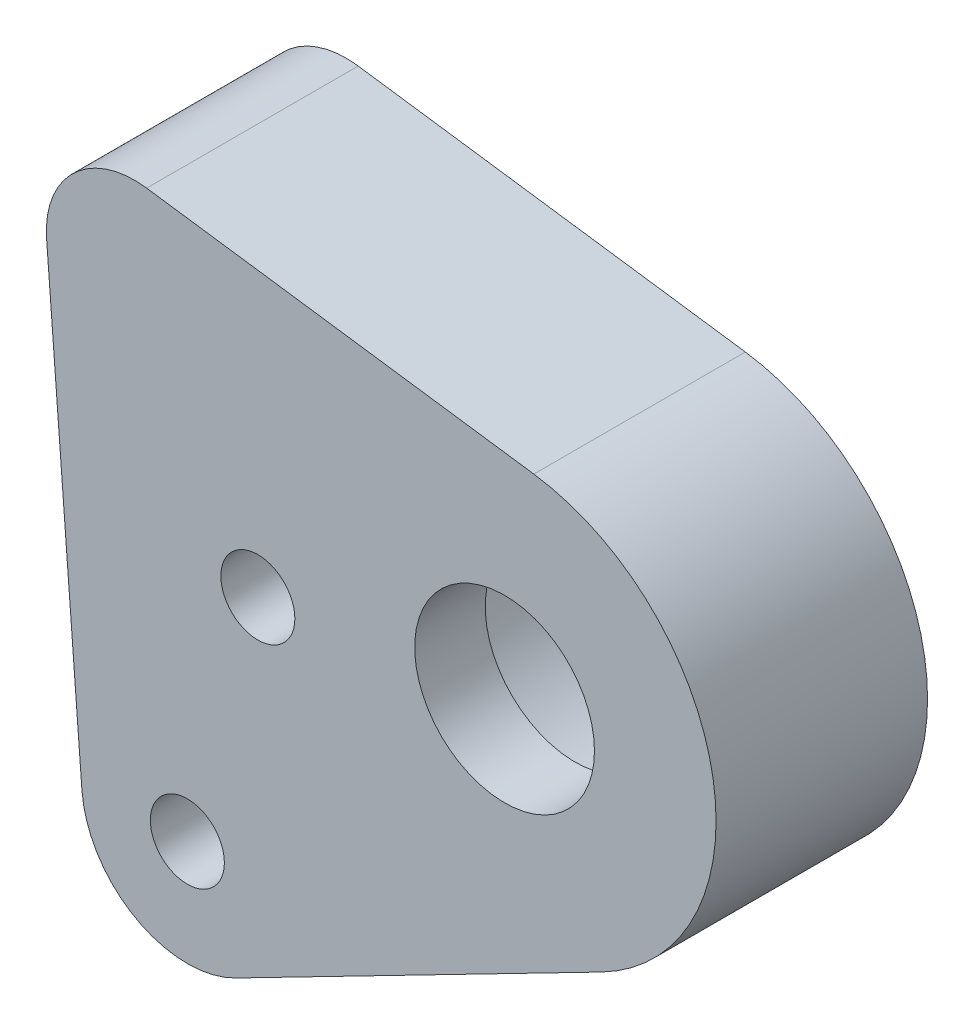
SolidWorks part; units mm, degrees
ref_plane "Alzado" through (0, 0, 0) normal (0, 0, 1) x (1, 0, 0)
ref_plane "Planta" through (0, 0, 0) normal (0, 1, 0) x (1, 0, 0)
ref_plane "Vista lateral" through (0, 0, 0) normal (1, 0, 0) x (0, 0, -1)
ref_plane "Plano1" through (0, 0, 54.4) normal (0, 0, 1) x (1, 0, 0)
sketch "Sk_Base_con_alojamiento_muelle" plane through (0, 0, 54.4) normal (0, 0, 1) x (1, 0, 0)
  line L0 (-31.9853, -16.3829) -> (-29.9824, -42.4595)
  line L1 (-21.2567, -47.3362) -> (-0.5135, -36.6723)
  line L2 (-4.3406, -14.1153) -> (-26.3086, -11.048)
  arc A0 (-29.9824, -42.4595) -> (-21.2567, -47.3362) centre (-24, -42) ccw
  arc A1 (-0.5135, -36.6723) -> (-4.3406, -14.1153) centre (-6, -26) ccw
  arc A2 (-26.3086, -11.048) -> (-31.9853, -16.3829) centre (-27, -16) ccw
  circle A3 centre (-6, -26) radius 9
  circle A4 centre (-20, -28) radius 2.1
  circle A5 centre (-24, -42) radius 2.1
extrude "Base_con_alojamiento_muelle" add sketch "Sk_Base_con_alojamiento_muelle" along normal blind 8
ref_plane "Plano2" through (0, 0, 62.4) normal (0, 0, 1) x (1, 0, 0)
sketch "Sk_Tapa" plane through (0, 0, 62.4) normal (0, 0, 1) x (1, 0, 0)
  line L0 (-31.9853, -16.3829) -> (-29.9824, -42.4595)
  line L1 (-21.2567, -47.3362) -> (-0.5135, -36.6723)
  line L2 (-4.3406, -14.1153) -> (-26.3086, -11.048)
  arc A0 (-29.9824, -42.4595) -> (-21.2567, -47.3362) centre (-24, -42) ccw
  arc A1 (-0.5135, -36.6723) -> (-4.3406, -14.1153) centre (-6, -26) ccw
  arc A2 (-26.3086, -11.048) -> (-31.9853, -16.3829) centre (-27, -16) ccw
  circle A3 centre (-6, -26) radius 5.1
  circle A4 centre (-20, -28) radius 2.1
  circle A5 centre (-24, -42) radius 2.1
extrude "Tapa" add sketch "Sk_Tapa" along normal blind 4
ref_plane "Plano3" through (-22.0388, 8.7292, 0) normal (-0.9297, 0.3683, 0) x (0, 0, -1)
sketch "Croquis1" plane through (-22.0388, 8.7292, 0) normal (-0.9297, 0.3683, 0) x (0, 0, -1)
  circle A2 centre (-60.633, 28.2858) radius 2.96
extrude "Cortar-Extruir1" cut sketch "Croquis1" against normal mid plane 41
thread "Rosca_M7x1" pitch 1 start angle 0, offset 11, length 11, pitch 1, diameter 5.92
ref_plane "Plano4" through (-23.6226, -21.0673, 63.593) normal (-0.3683, -0.9297, 0) x (0, 0, 1)
sketch "Perfil de rosca1" plane through (-23.6226, -21.0673, 63.593) normal (-0.3683, -0.9297, 0) x (0, 0, 1)
  line L0 (0, 0) -> (0, 1) construction
  line L1 (0, 0) -> (0.5413, 0.3125)
  line L2 (0.5413, 0.3125) -> (0.5413, 0.4375)
  line L3 (0.5413, 0.4375) -> (0, 0.75)
  line L4 (0.5413, 0.375) -> (0, 0.375) construction
  line L11 (0, 0) -> (0, 0.75)
  point P2 (0, 0)
  dimension "Pitch" = 1
  dimension "Profile_Angle" = 60
  dimension "Profile_Land" = 0.125
  dimension "Profile_Height" = 0.5413
